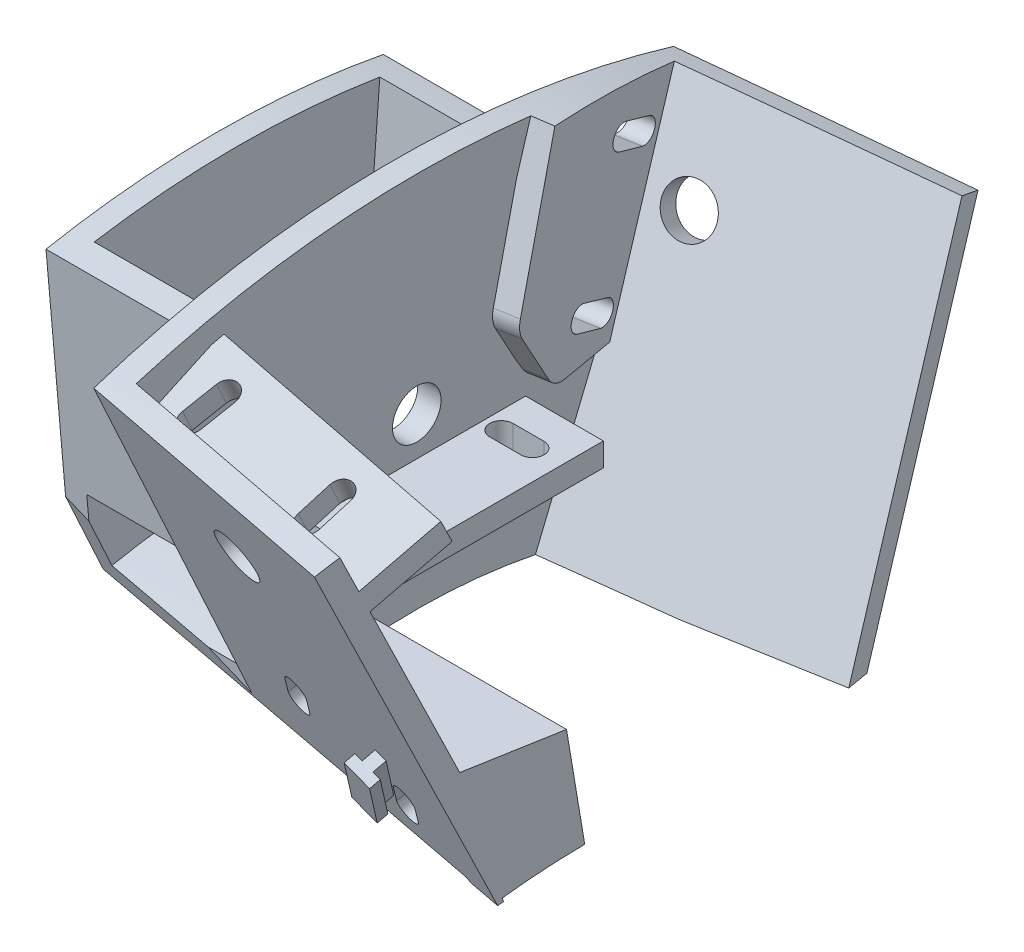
SolidWorks part; units mm, degrees
ref_plane "Front Plane" through (0, 0, 0) normal (0, 0, 1) x (1, 0, 0)
ref_plane "Top Plane" through (0, 0, 0) normal (0, 1, 0) x (1, 0, 0)
ref_plane "Right Plane" through (0, 0, 0) normal (1, 0, 0) x (0, 0, -1)
sketch "Sketch1" plane through (0, 0, 0) normal (1, 0, 0) x (0, 0, -1)
  circle A0 centre (0, 0) radius 80.01
  dimension "D1" = 160.02
sketch "Sketch2" plane through (0, 0, 0) normal (0, 0, 1) x (1, 0, 0)
  line L0 (-13, 116.5) -> (-13, 76.5)
  line L1 (-13, 76.5) -> (13, 76.5)
  line L2 (13, 76.5) -> (13, 116.5)
  line L3 (13, 116.5) -> (-13, 116.5)
  line L4 (0, -80.01) -> (0, 80.01) construction
  line L5 (-10.125, 89.5) -> (10.125, 89.5)
  line L6 (-10.125, 89.5) -> (-10.125, 79.5)
  line L7 (-10.125, 79.5) -> (10.125, 79.5)
  line L8 (10.125, 89.5) -> (10.125, 79.5)
  line L9 (0, -80.01) -> (0, 80.01)
  point P10 (0, 116.5)
  point P11 (0, 89.5)
  dimension "D1" = 20.25
  dimension "D2" = 10
  dimension "D3" = 3
  dimension "D4" = 40
  dimension "D5" = 26
  dimension "D6" = 26
  dimension "D7" = 79.5
sketch "Sketch3" plane through (0, 0, 0) normal (0, 0, 1) x (1, 0, 0)
  line L0 (-22.5, 0) -> (22.5, 0)
  point P2 (0, 0)
  dimension "D1" = 45
revolve "Revolve1" add sketch "Sketch2" angle 360 about L0
sketch "Sketch4" plane through (13, 0, 0) normal (1, 0, 0) x (0, 0, -1)
  line L0 (0, -133.5) -> (-21.7889, 115.5487)
  line L1 (0, -133.5) -> (21.7889, 115.5487)
  line L2 (-17.5547, 67.1516) -> (17.5547, 67.1516)
  circle A0 centre (0, -133.5) radius 250
  circle A1 centre (0, 0) radius 116.5 construction
  point P7 (0, 0)
  dimension "D1" = 500
  dimension "D2" = 10
  dimension "D3" = 200.6516
extrude "Cut-Extrude1" cut sketch "Sketch4" against normal through all flip side to cut contours L1 L0 M5 M4 | A0
sketch "Sketch6" plane through (13, 0, 0) normal (1, 0, 0) x (0, 0, -1)
  line L1 (-19, 123.4291) -> (19, 123.4291)
  line L2 (-19, 123.4291) -> (-16, 83.5418)
  line L3 (-16, 83.5418) -> (16, 83.5418)
  line L4 (19, 123.4291) -> (16, 83.5418)
  point P4 (0, 83.5418)
  point P7 (0, 123.4291)
  dimension "D1" = 38
  dimension "D2" = 40
  dimension "D3" = 83.5418
  dimension "D4" = 32
extrude "Cut-Extrude4" cut sketch "Sketch6" against normal up to surface (20.25 mm away) from surface at -2.875
ref_plane "Plane1" through (0, 0, 0) normal (1, 0, 0) x (0, 0, -1)
sketch "Sketch18" plane through (0, 0, 0) normal (0, 1, 0) x (1, 0, 0)
  line L0 (11.8117, 21.6939) -> (13, 14.955)
  line L1 (-13, 21.6939) -> (13, 21.6939) construction
  line L2 (13, -21.6939) -> (13, 21.6939) construction
  line L3 (13, 14.955) -> (13, 21.6939)
  line L4 (13, 21.6939) -> (11.8117, 21.6939)
  dimension "D1" = 10
  dimension "D2" = 6.7389
extrude "Cut-Extrude6" cut sketch "Sketch18" against normal through all both and the other way through all
sketch "Sketch19" plane through (15.1654, 0, -2.6741) normal (0.9848, 0, -0.1736) x (-0.1736, 0, -0.9848)
  line L0 (40.1835, 135.6657) -> (15.4244, 74.385)
  line L1 (15.4244, 74.385) -> (12.5492, 74.3965)
  line L2 (12.5492, 74.3965) -> (37.1835, 135.3685)
  line L3 (37.1835, 135.3685) -> (40.1835, 135.6657)
  line L4 (40.1835, 135.6657) -> (40.1835, 65.1638) construction
  ellipse E0 centre (-2.7153, 0) end of major axis (74.9648, 0) minor radius 76.5 (15.746, 74.3082) -> (12.4703, 75.024) ccw construction
  dimension "D1" = 22
  dimension "D2" = 3
extrude "Boss-Extrude5" add sketch "Sketch19" along normal blind 35
sketch "Sketch22" plane through (0, 0, 0) normal (0, 1, 0) x (1, 0, 0)
  line L0 (11.7934, -21.6939) -> (13, -14.8509)
  line L1 (-13, -21.6939) -> (13, -21.6939) construction
  line L2 (13, -21.6939) -> (13, 14.955) construction
  line L3 (13, -14.8509) -> (13, -21.6939)
  line L4 (13, -21.6939) -> (11.7934, -21.6939)
  dimension "D1" = 10
  dimension "D2" = 6.843
extrude "Cut-Extrude12" cut sketch "Sketch22" against normal through all both and the other way through all
sketch "Sketch23" plane through (15.1476, 0, 2.6709) normal (0.9848, 0, 0.1736) x (0.1736, 0, -0.9848)
  line L0 (-15.7927, 73.8604) -> (-39.6277, 126.4044)
  line L1 (-39.6277, 126.4044) -> (-36.8328, 127.4944)
  line L2 (-36.8328, 127.4944) -> (-12.7455, 74.3944)
  line L3 (-12.7455, 74.3944) -> (-15.7927, 73.8604)
  line L4 (-15.7927, 73.8604) -> (-15.7927, 80.7015) construction
  dimension "D1" = 24.4
  dimension "D2" = 3
extrude "Left wall" add sketch "Sketch23" along normal blind 35
sketch "Sketch24" plane through (0, 0, 0) normal (0, 1, 0) x (1, 0, 0)
  line L5 (44, 32.953) -> (47, 32.953)
  line L6 (44, 32.953) -> (44, -41.908)
  line L7 (44, -41.908) -> (47, -41.908)
  line L8 (47, 32.953) -> (47, -41.908)
  line L14 (10, 30.1077) -> (13, 30.1077)
  line L15 (10, 30.1077) -> (10, -39.4194)
  line L16 (10, -39.4194) -> (13, -39.4194)
  line L17 (13, 30.1077) -> (13, -39.4194)
  dimension "D1" = 3
  dimension "D2" = 3
  dimension "D3" = 31
extrude "Boss-Extrude7" add sketch "Sketch24" along normal blind 60 from offset 70 contours L17 L14 L15 L16
ref_plane "Plane5" through (17.7567, 0, -3.131) normal (-0.9848, 0, 0.1736) x (0, -1, 0)
sketch "Sketch31" plane through (17.7567, 0, -3.131) normal (-0.9848, 0, 0.1736) x (0, -1, 0)
  line L6 (-104.4857, -6.3175) -> (-94.994, -12.0495)
  line L16 (-104.4857, -6.3175) -> (-125.5882, -12.6183)
  line L17 (-94.994, -12.0495) -> (-94.994, -25.4494)
  line L18 (-94.994, -25.4494) -> (-125.5882, -34.5842)
  line L19 (-125.5882, -12.6183) -> (-125.5882, -34.5842)
extrude "Boss-Extrude8" add sketch "Sketch31" along normal blind 3
sketch "Sketch39" plane through (13, 0, 0) normal (1, 0, 0) x (0, 0, -1)
  line L0 (0, 0) -> (0, 116.5) construction
  line L2 (-21.6939, 114.4623) -> (-18.1809, 74.3082)
  line L3 (18.1809, 74.3082) -> (21.6939, 114.4623)
  line L4 (-21.6939, 114.4623) -> (-18.1809, 74.3082)
  line L5 (18.1809, 74.3082) -> (21.6939, 114.4623)
  circle A0 centre (0, 98.2529) radius 3.125
  arc A3 (18.1809, 74.3082) -> (-18.1809, 74.3082) centre (0, 0) ccw
  arc A4 (21.6939, 114.4623) -> (-21.6939, 114.4623) centre (0, 0) ccw
  arc A5 (18.1809, 74.3082) -> (-18.1809, 74.3082) centre (0, 0) ccw
  arc A6 (21.6939, 114.4623) -> (-21.6939, 114.4623) centre (0, 0) ccw
  dimension "D1" = 6.25
  dimension "D2" = 0
extrude "Cut-Extrude18" cut sketch "Sketch39" against normal through all contours A0 L0 | L0 A0
sketch "Sketch32" plane through (13, 0, 0) normal (1, 0, 0) x (0, 0, -1)
  line L1 (-14, 93.2529) -> (14, 93.2529)
  line L2 (-14, 93.2529) -> (-14, 90.2529)
  line L3 (-14, 90.2529) -> (14, 90.2529)
  line L4 (14, 93.2529) -> (14, 90.2529)
  line L7 (-21.6939, 114.4623) -> (-18.1809, 74.3082)
  line L8 (18.1809, 74.3082) -> (21.6939, 114.4623)
  line L9 (-21.6939, 114.4623) -> (-18.1809, 74.3082)
  line L10 (18.1809, 74.3082) -> (21.6939, 114.4623)
  arc A2 (18.1809, 74.3082) -> (-18.1809, 74.3082) centre (0, 0) ccw
  arc A3 (21.6939, 114.4623) -> (-21.6939, 114.4623) centre (0, 0) ccw
  arc A4 (18.1809, 74.3082) -> (-18.1809, 74.3082) centre (0, 0) ccw
  arc A5 (21.6939, 114.4623) -> (-21.6939, 114.4623) centre (0, 0) ccw
  point P4 (0, 98.2529)
  point P8 (0, 93.2529)
  point P13 (0, 76.5)
  dimension "D1" = 28
  dimension "D2" = 3
  dimension "D4" = 5
  dimension "D3" = 0
extrude "Boss-Extrude9" add sketch "Sketch32" along normal blind 10 contours L4 L1 L2 L3
sketch "Sketch33" plane through (3.0245, 7.9008, -17.1527) normal (0.1581, 0.4131, -0.8968) x (-0.9874, 0.065, -0.1442)
  line L1 (-41.9715, 119.2764) -> (-8.8934, 119.2764)
  line L2 (-41.9715, 119.2764) -> (-42.1862, 116.2764)
  line L3 (-42.1862, 116.2764) -> (-8.8934, 116.2764)
  line L4 (-8.8934, 119.2764) -> (-8.8934, 116.2764)
  line L5 (-45.039, 76.4262) -> (-40.8755, 134.5852) construction
  dimension "D1" = 3
extrude "Boss-Extrude10" add sketch "Sketch33" along normal blind 10
sketch "Sketch34" plane through (2.1838, 5.0811, 12.3851) normal (-0.161, -0.3746, -0.9131) x (-0.9867, 0.0423, 0.1566)
  line L1 (-64.9967, 163.2333) -> (28.8688, 163.2333)
  line L2 (-64.9967, 163.2333) -> (-64.9967, 44.8884)
  line L3 (-64.9967, 44.8884) -> (20.0554, 44.8884)
  line L4 (28.8688, 163.2333) -> (20.0554, 44.8884)
extrude "Cut-Extrude15" cut sketch "Sketch34" along normal through all
sketch "Sketch35" plane through (10, 0, 0) normal (-1, 0, 0) x (0, 0, 1)
  line L1 (30.5026, 133.388) -> (44.3384, 133.388)
  line L2 (30.5026, 133.388) -> (30.5026, 102.7864)
  line L3 (30.5026, 102.7864) -> (44.3384, 102.7864)
  line L4 (44.3384, 133.388) -> (44.3384, 102.7864)
  line L5 (-43.2557, 141.0048) -> (-26.5999, 141.0048)
  line L6 (-43.2557, 141.0048) -> (-43.2557, 114.7696)
  line L7 (-43.2557, 114.7696) -> (-26.5999, 114.7696)
  line L8 (-26.5999, 141.0048) -> (-26.5999, 114.7696)
extrude "Cut-Extrude17" cut sketch "Sketch35" along normal blind 10
sketch "Sketch37" plane through (0, 0, 0) normal (1, 0, 0) x (0, 0, -1)
  point P0 (0, 0)
sketch "Sketch38" plane through (13, 0, 0) normal (1, 0, 0) x (0, 0, -1)
  line L0 (0, 0) -> (-11.0658, 75.6954) construction
  line L1 (-13.8735, 73.8166) -> (-16.0663, 88.8166)
  line L3 (-16.0663, 88.8166) -> (-27.7433, 88.8166)
  line L5 (-27.7433, 88.8166) -> (-22.8378, 72.0405)
  line L6 (-22.8378, 72.0405) -> (-13.8735, 73.8166)
  line L7 (-21.3005, 74.3944) -> (-37.5542, 110.7783) construction
  arc A0 (15.2667, 74.9612) -> (-15.4757, 74.9183) centre (0, 0) ccw construction
  dimension "D1" = 3.05
  dimension "D2" = 15
extrude "Boss-Extrude11" add sketch "Sketch38" along normal up to surface (33.2666 mm away)
sketch "Sketch26" plane through (2.5508, 6.6633, -14.4661) normal (-0.1581, -0.4131, 0.8968) x (0.9874, -0.0677, 0.1429)
  line L1 (-55.3623, 142.6529) -> (75.8644, 142.6529)
  line L2 (-55.3623, 142.6529) -> (-58.8861, 34.4442)
  line L3 (-58.8861, 34.4442) -> (75.8644, 34.4442)
  line L4 (75.8644, 142.6529) -> (75.8644, 34.4442)
extrude "Cut-Extrude13" cut sketch "Sketch26" along normal blind 50
sketch "Sketch30" plane through (-13, 0, 0) normal (-1, 0, 0) x (0, 0, 1)
  arc A1 (14.3357, 75.1448) -> (-13.7284, 75.2581) centre (0, 0) ccw construction
  arc A3 (14.3357, 75.1448) -> (-13.7284, 75.2581) centre (0, 0) ccw
  circle A4 centre (0, 0) radius 76.5
  circle A6 centre (0, 0) radius 125.0029
  dimension "D1" = 250.0058
extrude "Cut-Extrude16" cut sketch "Sketch30" against normal through all flip side to cut contours A6 A4 M6 M5 M4 | M6 M3 M4 M5
sketch "Sketch41" plane through (3.0245, 7.9008, -17.1527) normal (0.1581, 0.4131, -0.8968) x (-0.9874, 0.0651, -0.1441)
  line L0 (-42.1711, 116.2819) -> (-8.8783, 116.2776) construction
  circle A0 centre (-23.1451, 111.2794) radius 3.125
  dimension "D2" = 6.25
  dimension "D1" = 5
extrude "Cut-Extrude19" cut sketch "Sketch41" against normal blind 20
sketch "Sketch42" plane through (2.6137, 6.0814, 14.8232) normal (0.161, 0.3746, 0.9131) x (0.9867, -0.0423, -0.1566)
  line L0 (12.3932, 123.9403) -> (13.6401, 96.6177) construction
  circle A0 centre (17.9696, 111.4233) radius 3.125
  dimension "D2" = 6.25
  dimension "D1" = 5
extrude "Cut-Extrude20" cut sketch "Sketch42" against normal blind 20
fillet "Fillet1" radius 3 2 edges at (14.3322, 94.994, -14.7625) (15.1825, 104.4857, -9.0921)
sketch "Sketch44" plane through (-0.1431, 105.6207, 48.6256) normal (0.0012, -0.9084, -0.4182) x (1, 0.0011, 0.0005)
  line L0 (27.6857, -14.9352) -> (29.2672, -24.8093)
  line L1 (44.6799, -12.2134) -> (13.1432, -17.2643) construction
  line L2 (46.2614, -22.0876) -> (13.3875, -27.3526) construction
sketch "Sketch43" plane through (-0.1431, 105.6207, 48.6256) normal (0.0012, -0.9084, -0.4182) x (1, 0.0011, 0.0005)
  line L0 (34.8722, -15.6949) -> (35.3396, -19.6675) construction
  line L4 (25.5341, -13.8748) -> (27.1327, -23.7462)
  line L5 (36.3619, -15.5197) -> (36.8293, -19.4923)
  line L8 (33.3825, -15.8702) -> (33.8499, -19.8428)
  line L9 (17.2477, -18.5492) -> (18.058, -22.4663) construction
  line L12 (15.7788, -18.8531) -> (16.5891, -22.7701)
  line L13 (18.7166, -18.2453) -> (19.5269, -22.1624)
  arc A6 (36.3619, -15.5197) -> (33.3825, -15.8702) centre (34.8722, -15.6949) ccw
  arc A7 (33.8499, -19.8428) -> (36.8293, -19.4923) centre (35.3396, -19.6675) ccw
  arc A10 (15.7788, -18.8531) -> (18.7166, -18.2453) centre (17.2477, -18.5492) cw
  arc A11 (19.5269, -22.1624) -> (16.5891, -22.7701) centre (18.058, -22.4663) cw
  point P2 (35.1059, -17.6812)
  point P12 (17.6529, -20.5077)
  dimension "D2" = 4
  dimension "D1" = 1.5
extrude "Cut-Extrude21" cut sketch "Sketch43" against normal blind 10
sketch "Sketch45" plane through (0, 93.2529, 0) normal (0, 1, 0) x (1, 0, 0)
  line L0 (15.2321, 8.6421) -> (19.2321, 8.6421) construction
  line L3 (13, -0.2515) -> (23, -0.2515)
  line L4 (13, -36.0932) -> (13, 14.666) construction
  line L5 (23, -14) -> (23, 14) construction
  line L6 (15.2321, -9.1451) -> (19.2321, -9.1451) construction
  line L9 (15.2321, 10.1421) -> (19.2321, 10.1421)
  line L10 (15.2321, 7.1421) -> (19.2321, 7.1421)
  line L12 (15.2321, -10.6451) -> (19.2321, -10.6451)
  line L13 (15.2321, -7.6451) -> (19.2321, -7.6451)
  arc A4 (15.2321, 10.1421) -> (15.2321, 7.1421) centre (15.2321, 8.6421) ccw
  arc A5 (19.2321, 7.1421) -> (19.2321, 10.1421) centre (19.2321, 8.6421) ccw
  arc A6 (15.2321, -10.6451) -> (15.2321, -7.6451) centre (15.2321, -9.1451) cw
  arc A7 (19.2321, -7.6451) -> (19.2321, -10.6451) centre (19.2321, -9.1451) cw
  point P2 (17.2321, 8.6421)
  point P15 (17.2321, -9.1451)
  dimension "D2" = 4
  dimension "D1" = 1.5
extrude "Cut-Extrude22" cut sketch "Sketch45" against normal blind 10 contours L10 A5 L9 A4 | A7 L13 A6 L12
sketch "Sketch47" plane through (17.7567, 0, -3.131) normal (0.9848, 0, -0.1736) x (-0.1736, 0, -0.9848)
  line L0 (22.8887, 116.6986) -> (26.5974, 115.2001) construction
  line L1 (23.4506, 118.0893) -> (27.1593, 116.5909)
  line L2 (22.3267, 115.3078) -> (26.0355, 113.8094)
  line L3 (30.5022, 118.8319) -> (12.5492, 74.3965) construction
  line L4 (25.3721, 106.1343) -> (8.808, 112.8266)
  line L5 (6.6974, 105.7581) -> (12.1697, 124.0856) construction
  line L6 (16.2471, 100.2602) -> (19.9559, 98.7617) construction
  line L7 (15.6852, 98.8694) -> (19.3939, 97.371)
  line L8 (16.809, 101.6509) -> (20.5178, 100.1525)
  arc A0 (23.4506, 118.0893) -> (22.3267, 115.3078) centre (22.8887, 116.6986) ccw
  arc A1 (26.0355, 113.8094) -> (27.1593, 116.5909) centre (26.5974, 115.2001) ccw
  arc A2 (15.6852, 98.8694) -> (16.809, 101.6509) centre (16.2471, 100.2602) cw
  arc A3 (20.5178, 100.1525) -> (19.3939, 97.371) centre (19.9559, 98.7617) cw
  point P2 (24.743, 115.9493)
  point P15 (18.1015, 99.511)
  dimension "D1" = 1.5
  dimension "D2" = 4
extrude "Cut-Extrude23" cut sketch "Sketch47" against normal blind 10 contours L2 A1 L1 A0 | A3 L8 A2 L7
sketch "Sketch48" plane through (0, -0.4412, 3.0179) normal (0, 0.1447, -0.9895) x (-1, 0, 0)
  line L0 (-36.6828, 82.7622) -> (-35.7045, 79.9262) construction
  line L1 (-35.2648, 83.2514) -> (-34.2865, 80.4154)
  line L2 (-38.1008, 82.2731) -> (-37.1225, 79.4371)
  line L3 (-31.3294, 90.2065) -> (-26.5802, 76.4392)
  line L4 (-48.3256, 90.2065) -> (-13, 90.2065) construction
  line L5 (-48.6768, 76.4392) -> (-13, 76.4392) construction
  line L6 (-22.5248, 87.6462) -> (-21.5465, 84.8102) construction
  line L7 (-23.9428, 87.157) -> (-22.9645, 84.321)
  line L8 (-21.1068, 88.1354) -> (-20.1285, 85.2994)
  line L9 (-22.5248, 87.6462) -> (-21.5465, 84.8102) construction
  line L10 (-23.9428, 87.157) -> (-22.9645, 84.321)
  line L11 (-21.1068, 88.1354) -> (-20.1285, 85.2994)
  arc A0 (-35.2648, 83.2514) -> (-38.1008, 82.2731) centre (-36.6828, 82.7622) ccw
  arc A1 (-37.1225, 79.4371) -> (-34.2865, 80.4154) centre (-35.7045, 79.9262) ccw
  arc A2 (-23.9428, 87.157) -> (-21.1068, 88.1354) centre (-22.5248, 87.6462) cw
  arc A3 (-20.1285, 85.2994) -> (-22.9645, 84.321) centre (-21.5465, 84.8102) cw
  arc A4 (-23.9428, 87.157) -> (-21.1068, 88.1354) centre (-22.5248, 87.6462) cw
  arc A5 (-20.1285, 85.2994) -> (-22.9645, 84.321) centre (-21.5465, 84.8102) cw
  point P2 (-36.1936, 81.3442)
  point P15 (-22.0357, 86.2282)
  point P22 (-22.0357, 86.2282)
  dimension "D1" = 1.5
  dimension "D2" = 3
extrude "Cut-Extrude24" cut sketch "Sketch48" against normal through all contours A3 L8 A2 L7 | L2 A1 L1 A0
sketch "Sketch50" plane through (0, -0.4774, 1.6327) normal (0, -0.2807, 0.9598) x (1, 0, 0)
  line L1 (31.1072, 79.4379) -> (47.62, 79.4379)
  line L2 (31.1072, 79.4379) -> (31.1072, 76.0004)
  line L3 (31.1072, 76.0004) -> (47.62, 76.0004)
  line L4 (47.62, 79.4379) -> (47.62, 76.0004)
extrude "Boss-Extrude13" add sketch "Sketch50" against normal up to surface (1.2707 mm away)
sketch "Sketch51" plane through (49.6159, 0, 8.7486) normal (0.9848, 0, 0.1736) x (0.1736, 0, -0.9848)
  line L1 (-20.8257, 79.8943) -> (-9.0044, 79.8943)
  line L2 (-20.8257, 79.8943) -> (-20.8257, 69.8171)
  line L3 (-20.8257, 69.8171) -> (-9.0044, 69.8171)
  line L4 (-9.0044, 79.8943) -> (-9.0044, 69.8171)
extrude "Cut-Extrude27" cut sketch "Sketch51" along normal blind 10
sketch "Sketch55" plane through (2.5508, 6.6633, -14.4661) normal (-0.1581, -0.4131, 0.8968) x (0.9874, -0.0626, 0.1453)
  line L0 (31.02, 81.83) -> (32.4336, 81.3281)
  line L1 (32.4336, 81.3281) -> (35.2777, 89.3382)
  line L2 (35.2777, 89.3382) -> (33.8641, 89.8401)
  line L3 (33.8641, 89.8401) -> (31.02, 81.83)
  dimension "D1" = 1.5
  dimension "D2" = 8.5
extrude "Boss-Extrude14" add sketch "Sketch55" along normal blind 1.6
sketch "Sketch56" plane through (2.2977, 6.0024, -13.0311) normal (-0.1581, -0.4131, 0.8968) x (0.9874, -0.0626, 0.1453)
  line L0 (32.9218, 90.1747) -> (30.0777, 82.1646)
  line L1 (30.0777, 82.1646) -> (33.3759, 80.9935)
  line L2 (33.3759, 80.9935) -> (36.22, 89.0036)
  line L3 (36.22, 89.0036) -> (32.9218, 90.1747)
  line L4 (32.4336, 81.3281) -> (35.2777, 89.3382) construction
  line L5 (35.2777, 89.3382) -> (33.8641, 89.8401) construction
  point P8 (34.5709, 89.5891)
  point P9 (34.5709, 89.5891)
  dimension "D1" = 3.5
  dimension "D2" = 8.5
extrude "Boss-Extrude15" add sketch "Sketch56" along normal blind 1.3
sketch "Sketch57" plane through (2.1838, 5.0811, 12.3851) normal (-0.161, -0.3746, -0.9131) x (-0.9867, 0.0423, 0.1566)
  line L4 (-32.3501, 91.1822) -> (-29.7831, 83.0791)
  line L5 (-29.7831, 83.0791) -> (-28.1148, 83.6076)
  line L6 (-28.1148, 83.6076) -> (-30.6818, 91.7107)
  line L7 (-30.6818, 91.7107) -> (-32.3501, 91.1822)
  line L9 (-31.6514, 88.9767) -> (-49.7714, 146.1752) construction
  line L10 (-32.1117, 91.2577) -> (-29.5447, 83.1546)
  dimension "D1" = 8.5
  dimension "D2" = 1.75
  dimension "D3" = 1.5
extrude "Boss-Extrude16" add sketch "Sketch57" along normal blind 1.6 contours L7 L10 L5 L6
sketch "Sketch60" plane through (-10.125, 0, 0) normal (1, 0, 0) x (0, 0, -1)
  line L0 (25.3719, 99.8427) -> (23.3064, 94.6517)
  line L1 (23.3064, 94.6517) -> (12.0893, 99.1149)
  line L2 (12.0893, 99.1149) -> (14.1548, 104.3059)
  line L3 (14.1548, 104.3059) -> (25.3719, 99.8427)
  line L4 (13.6349, 98.8694) -> (17.4009, 97.371) construction
extrude "Cut-Extrude28" cut sketch "Sketch60" along normal up to surface (10.125 mm away) from offset 10
sketch "Sketch61" plane through (10, 0, 0) normal (-1, 0, 0) x (0, 0, 1)
  line L1 (-26.6835, 101.065) -> (-35.0862, 101.065)
  line L2 (-26.6835, 101.065) -> (-26.6835, 116.8199)
  line L3 (-26.6835, 116.8199) -> (-35.0862, 116.8199)
  line L4 (-35.0862, 101.065) -> (-35.0862, 116.8199)
extrude "Cut-Extrude29" cut sketch "Sketch61" along normal blind 10
sketch "Sketch62" plane through (1.9262, 4.4817, 10.9241) normal (-0.161, -0.3746, -0.9131) x (-0.987, 0.0611, 0.149)
  line L0 (-31.2072, 91.6098) -> (-28.8056, 83.4561)
  line L1 (-28.8056, 83.4561) -> (-25.4482, 84.445)
  line L2 (-25.4482, 84.445) -> (-27.8498, 92.5987)
  line L3 (-27.8498, 92.5987) -> (-31.2072, 91.6098)
  line L4 (-28.809, 92.3162) -> (-30.2479, 91.8923) construction
  line L5 (-28.809, 92.3162) -> (-30.2479, 91.8923) construction
  point P6 (-29.5285, 92.1042)
  point P9 (-29.5285, 92.1042)
  dimension "D1" = 3.5
  dimension "D2" = 8.5
extrude "Boss-Extrude17" add sketch "Sketch62" along normal blind 1.3
